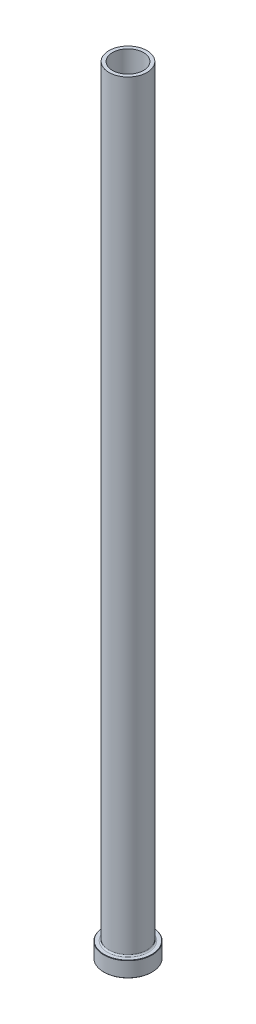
SolidWorks part; units mm, degrees
ref_plane "Front Plane" through (0, 0, 0) normal (0, 0, 1) x (1, 0, 0)
ref_plane "Top Plane" through (0, 0, 0) normal (0, 1, 0) x (1, 0, 0)
ref_plane "Right Plane" through (0, 0, 0) normal (1, 0, 0) x (0, 0, -1)
sketch "Sketch1" plane through (0, 0, 0) normal (0, 0, 1) x (1, 0, 0)
  line L0 (-9, 450) -> (-11, 450)
  line L1 (-11, 450) -> (-11, 9)
  line L2 (-11, 9) -> (-14, 9)
  line L3 (-14, 9) -> (-14, 0)
  line L4 (15.4, 0) -> (-15.4, 0) construction
  line L5 (-14, 0) -> (-9.25, 0)
  line L6 (-9, 395) -> (-9, 450)
  line L7 (0, 92.1877) -> (0, -15.5353) construction
  line L8 (0, -15.4) -> (0, 15.4) construction
  line L9 (-9, 395) -> (-9.25, 383)
  line L10 (-9.25, 383) -> (-9.25, 0)
  dimension "D1" = 0.25
  dimension "ID" = 18
  dimension "OD" = 22
  dimension "L" = 450
  dimension "H" = 28
  dimension "T" = 9
  dimension "N" = 55
  dimension "D2" = 12
revolve "Revolve1" add sketch "Sketch1" angle 360 about L7
fillet "Fillet1" radius 0.8 1 edges at (0, 9, 11)
chamfer "Chamfer1" distance 0.2 angle 45 2 edges at (0, 9, 14) (0, 0, 14)
chamfer "Chamfer3" distance 0.5 angle 45 1 edges at (0, 0, 9.25)
